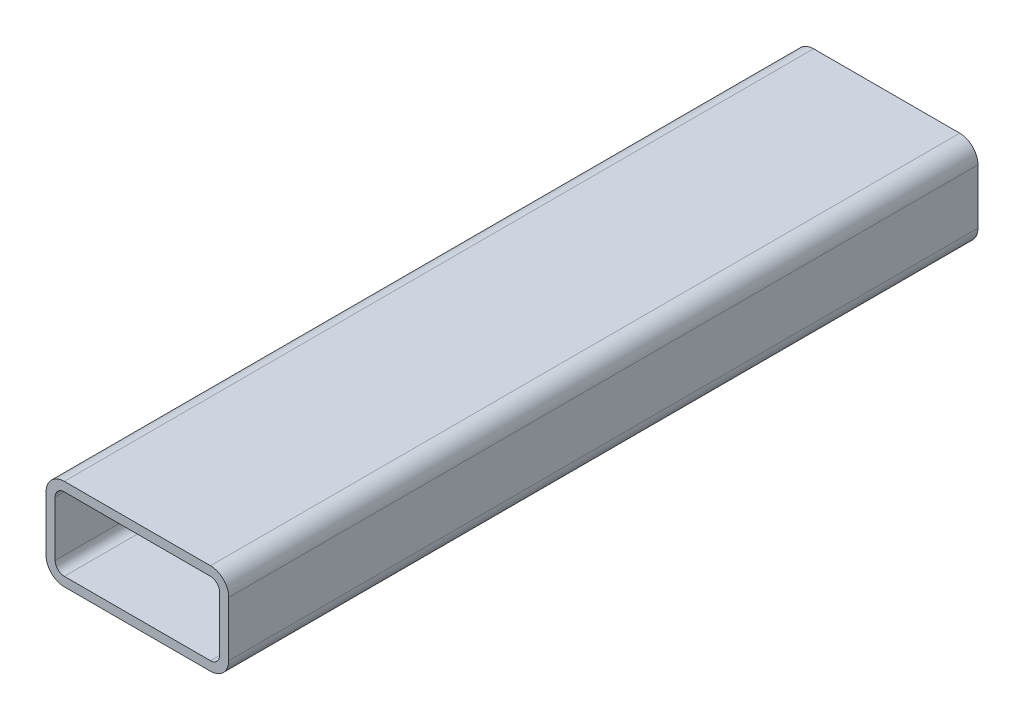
SolidWorks part; units mm, degrees
ref_plane "Plan de face" through (0, 0, 0) normal (0, 0, 1) x (1, 0, 0)
ref_plane "Plan de dessus" through (0, 0, 0) normal (0, 1, 0) x (1, 0, 0)
ref_plane "Plan de droite" through (0, 0, 0) normal (1, 0, 0) x (0, 0, -1)
sketch "Esquisse1" plane through (0, 0, 0) normal (0, 0, 1) x (1, 0, 0)
  line L0 (12, 0) -> (108, 0)
  line L1 (120, 12) -> (120, 48)
  line L2 (108, 60) -> (12, 60)
  line L3 (0, 48) -> (0, 12)
  line L4 (12, 6) -> (108, 6)
  line L5 (114, 12) -> (114, 48)
  line L6 (108, 54) -> (12, 54)
  line L7 (6, 48) -> (6, 12)
  arc A0 (108, 0) -> (120, 12) centre (108, 12) ccw
  arc A1 (120, 48) -> (108, 60) centre (108, 48) ccw
  arc A2 (12, 60) -> (0, 48) centre (12, 48) ccw
  arc A3 (0, 12) -> (12, 0) centre (12, 12) ccw
  arc A4 (108, 6) -> (114, 12) centre (108, 12) ccw
  arc A5 (114, 48) -> (108, 54) centre (108, 48) ccw
  arc A6 (12, 54) -> (6, 48) centre (12, 48) ccw
  arc A7 (6, 12) -> (12, 6) centre (12, 12) ccw
  dimension "D1" = 120
  dimension "D2" = 60
  dimension "D3" = 6
extrude "Extrusion1" add sketch "Esquisse1" along normal mid plane 492
